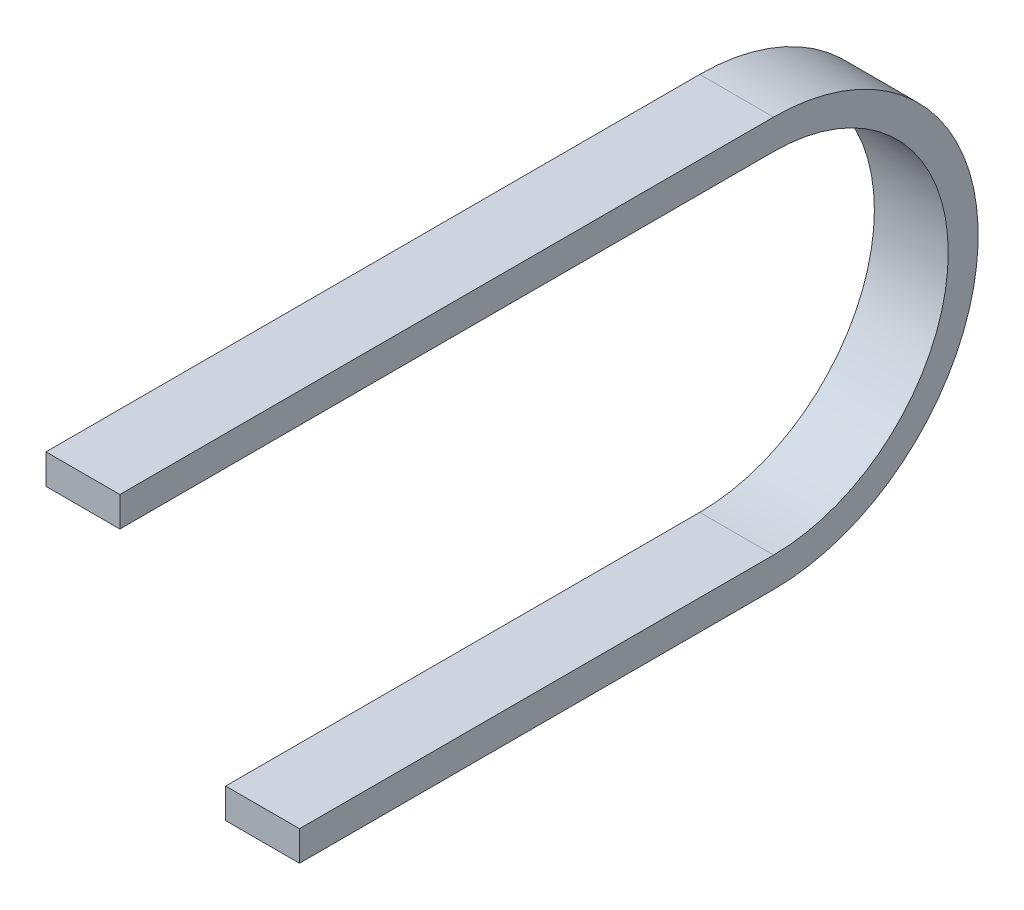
SolidWorks part; units mm, degrees
ref_plane "Plan de face" through (0, 0, 0) normal (0, 0, 1) x (1, 0, 0)
ref_plane "Plan de dessus" through (0, 0, 0) normal (0, 1, 0) x (1, 0, 0)
ref_plane "Plan de droite" through (0, 0, 0) normal (1, 0, 0) x (0, 0, -1)
sketch "Esquisse1" plane through (0, 0, 0) normal (0, 0, 1) x (1, 0, 0)
  line L1 (-18.5, 7.5) -> (18.5, 7.5)
  line L2 (-18.5, 7.5) -> (-18.5, -7.5)
  line L3 (-18.5, -7.5) -> (18.5, -7.5)
  line L4 (18.5, 7.5) -> (18.5, -7.5)
  dimension "D1" = 37
  dimension "D2" = 15
  dimension "D3" = 7.5
  dimension "D4" = 18.5
sketch "Esquisse4" plane through (0, 0, 0) normal (1, 0, 0) x (0, 0, -1)
  line L0 (0, 0) -> (327.5, 0)
  line L1 (327.5, -190) -> (90, -190)
  arc A0 (327.5, 0) -> (327.5, -190) centre (327.5, -95) cw
  dimension "D1" = 190
  dimension "D2" = 327.5
  dimension "D3" = 237.5
sweep "Balayage1" add profiles "Esquisse1" path "Esquisse4"
